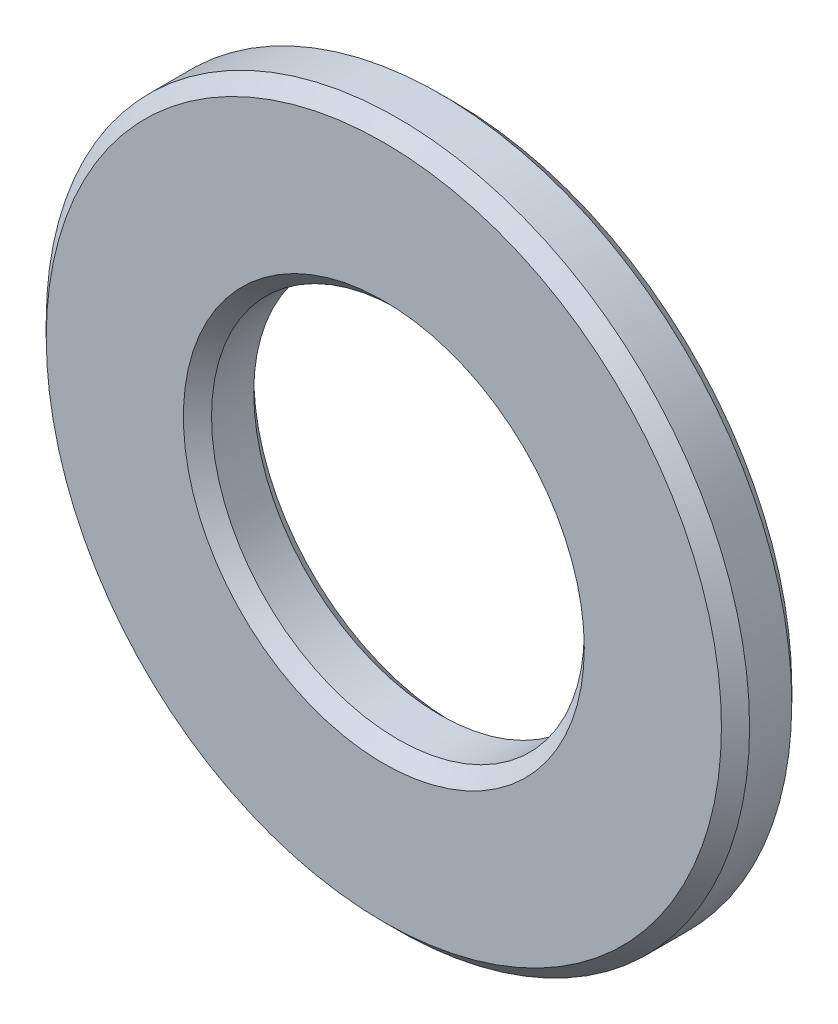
SolidWorks part; units mm, degrees
ref_plane "Front Plane" through (0, 0, 0) normal (0, 0, 1) x (1, 0, 0)
ref_plane "Top Plane" through (0, 0, 0) normal (0, 1, 0) x (1, 0, 0)
ref_plane "Right Plane" through (0, 0, 0) normal (1, 0, 0) x (0, 0, -1)
sketch "Sketch1" plane through (0, 0, 0) normal (0, 0, 1) x (1, 0, 0)
  circle A0 centre (0, 0) radius 5
  circle A1 centre (0, 0) radius 2.65
  dimension "D1" = 10
  dimension "D2" = 5.3
extrude "Boss-Extrude2" add sketch "Sketch1" along normal mid plane 1
chamfer "Chamfer3" distance 0.2 angle 45 4 edges at (5, 0, 0.5) (5, 0, -0.5) (2.65, 0, -0.5) (2.65, 0, 0.5)
